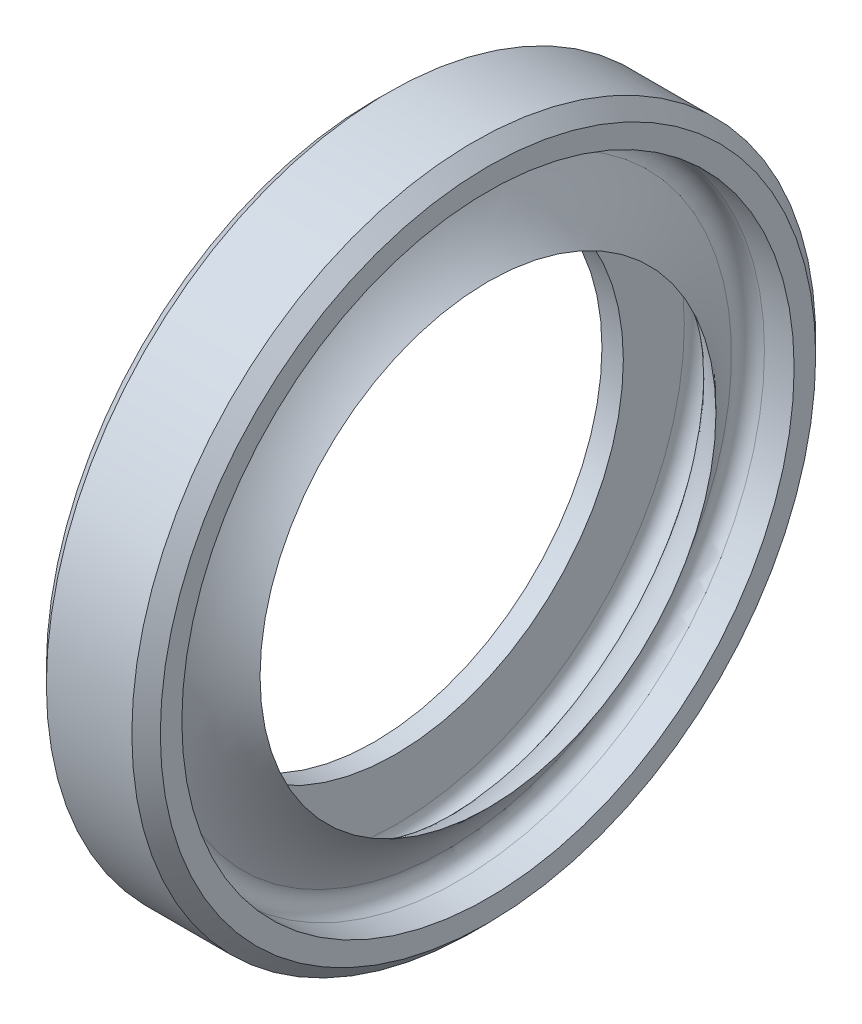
SolidWorks part; units mm, degrees
ref_plane "Face" through (0, 0, 0) normal (0, 0, 1) x (1, 0, 0)
ref_plane "Dessus" through (0, 0, 0) normal (0, 1, 0) x (1, 0, 0)
ref_plane "Droite" through (0, 0, 0) normal (1, 0, 0) x (0, 0, -1)
sketch "Esquisse2" plane through (0, 0, 0) normal (0, 0, 1) x (1, 0, 0)
  line L0 (-28.1734, 0) -> (34.1656, 0) construction
  line L1 (-5.1194, 16) -> (-5.1194, 23)
  line L2 (-4.1194, 24) -> (1.8806, 24)
  line L3 (2.8806, 23) -> (2.8806, 21.49)
  line L4 (2.8806, 21.49) -> (0.7966, 21.49)
  line L5 (-3.6194, 20.2799) -> (-3.6194, 16)
  line L6 (-3.6194, 16) -> (-5.1194, 16)
  line L8 (-5.1194, 23) -> (-4.1194, 24)
  line L9 (1.8806, 24) -> (2.8806, 23)
  arc A0 (-0.1214, 20.0935) -> (2.8806, 16) centre (10.3199, 24.6034) ccw
  arc A1 (2.8806, 16) -> (-1.7635, 20.8228) centre (6.3413, 23.9799) cw
  arc A2 (0.7966, 21.49) -> (-0.1214, 20.0935) centre (0.7966, 20.49) ccw
  arc A3 (-1.7635, 20.8228) -> (-3.6194, 20.2799) centre (-2.6108, 20.2756) ccw
  point P4 (-5.1194, 24)
  point P6 (2.8806, 24)
  point P20 (-0.6194, 21.49)
  point P23 (-2.1194, 21.49)
  dimension "D9" = 1
  dimension "D1" = 16
  dimension "D2" = 24
  dimension "D4" = 16
  dimension "D5" = 8
  dimension "D6" = 1.5
  dimension "D7" = 1.5
  dimension "D8" = 3.5
revolve "Révolution1" add sketch "Esquisse2" angle 360 about L0
